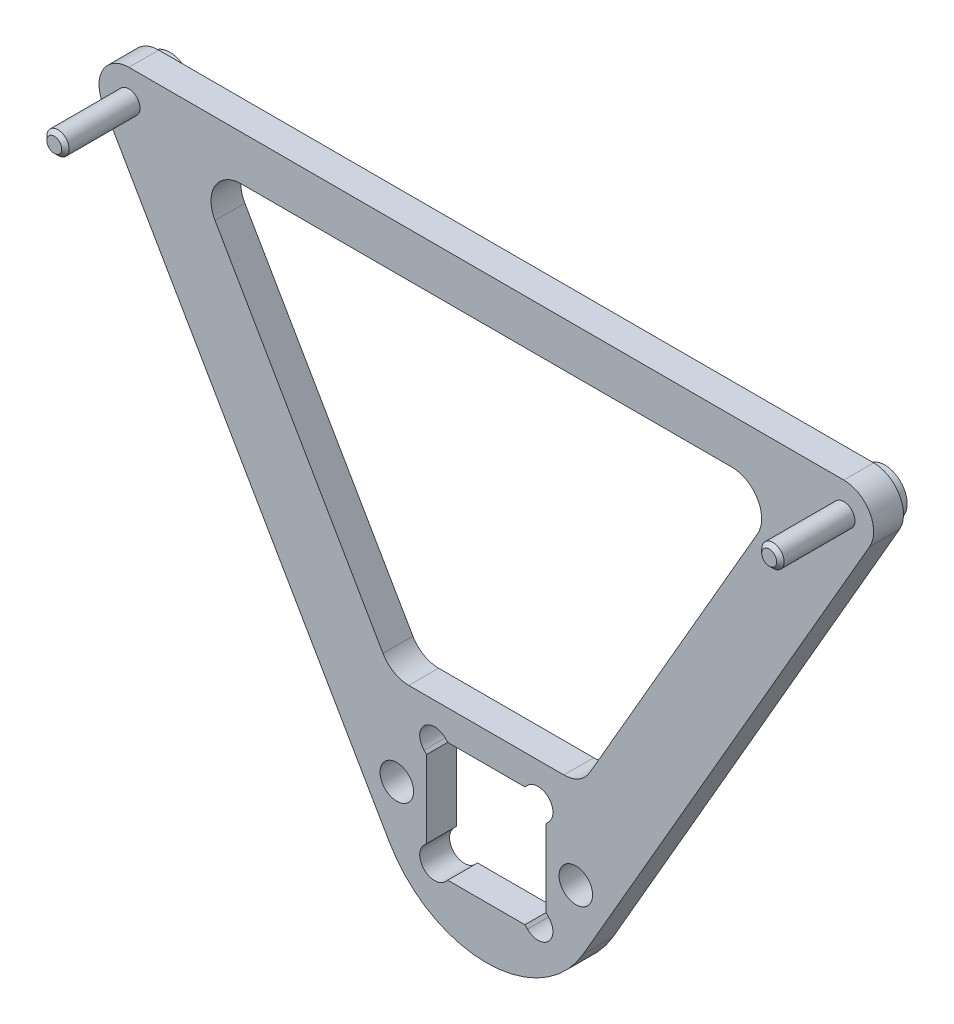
SolidWorks part; units mm, degrees
ref_plane "Plan de face" through (0, 0, 0) normal (0, 0, 1) x (1, 0, 0)
ref_plane "Plan de dessus" through (0, 0, 0) normal (0, 1, 0) x (1, 0, 0)
ref_plane "Plan de droite" through (0, 0, 0) normal (1, 0, 0) x (0, 0, -1)
sketch "Esquisse1" plane through (0, 0, 0) normal (0, 0, 1) x (1, 0, 0)
  line L0 (8.9257, 7.0549) -> (10.6336, 5.347) construction
  line L1 (-5.1716, 8) -> (5.1716, 8)
  line L2 (-8, 5.1716) -> (-8, -5.1716)
  line L3 (-5.1716, -8) -> (5.1716, -8)
  line L4 (8, 5.1716) -> (8, -5.1716)
  line L5 (7.9903, 7.9903) -> (6.9296, 6.9296) construction
  line L6 (8.3439, 5.5154) -> (3.5743, 10.285) construction
  line L7 (5.5154, 8.3439) -> (5.1716, 8)
  line L8 (8.3439, 5.5154) -> (8, 5.1716)
  line L9 (8.3439, -5.5154) -> (8, -5.1716)
  line L10 (5.5154, -8.3439) -> (5.1716, -8)
  line L11 (7.9903, -7.9903) -> (6.9296, -6.9296) construction
  line L12 (-5.5154, -8.3439) -> (-5.1716, -8)
  line L13 (-8.3439, -5.5154) -> (-8, -5.1716)
  line L14 (-7.9903, -7.9903) -> (-6.9296, -6.9296) construction
  line L15 (-8.3439, 5.5154) -> (-8, 5.1716)
  line L16 (-5.5154, 8.3439) -> (-5.1716, 8)
  line L17 (-7.9903, 7.9903) -> (-6.9296, 6.9296) construction
  line L18 (0, 40.1579) -> (0, -28.9881) construction
  line L19 (12.9904, -7.5) -> (51.3842, 59)
  line L20 (-12.9904, -7.5) -> (-51.3842, 59)
  line L21 (-47.9201, 65) -> (47.9201, 65)
  line L22 (-13.8564, 14) -> (-36.3731, 53)
  line L23 (10.3923, 12) -> (-10.3923, 12)
  line L24 (12.9904, -7.5) -> (54.8483, 65) construction
  line L25 (13.8564, 14) -> (36.3731, 53)
  line L26 (-4.3301, -2.5) -> (-37.5278, 55) construction
  line L27 (4.3301, -2.5) -> (37.5278, 55) construction
  line L28 (-32.909, 59) -> (32.909, 59)
  line L29 (-54.8483, 65) -> (54.8483, 65) construction
  line L30 (-37.5278, 55) -> (37.5278, 55) construction
  line L31 (-12.9904, -7.5) -> (-54.8483, 65) construction
  arc A0 (8.3439, 5.5154) -> (5.5154, 8.3439) centre (6.9296, 6.9296) ccw
  arc A1 (5.5154, -8.3439) -> (8.3439, -5.5154) centre (6.9296, -6.9296) ccw
  arc A2 (-8.3439, -5.5154) -> (-5.5154, -8.3439) centre (-6.9296, -6.9296) ccw
  arc A3 (-5.5154, 8.3439) -> (-8.3439, 5.5154) centre (-6.9296, 6.9296) ccw
  arc A4 (51.3842, 59) -> (47.9201, 65) centre (47.9201, 61) ccw
  arc A5 (-12.9904, -7.5) -> (12.9904, -7.5) centre (0, 0) ccw
  arc A6 (-51.3842, 59) -> (-47.9201, 65) centre (-47.9201, 61) cw
  arc A7 (-36.3731, 53) -> (-32.909, 59) centre (-32.909, 55) cw
  arc A8 (36.3731, 53) -> (32.909, 59) centre (32.909, 55) ccw
  arc A9 (13.8564, 14) -> (10.3923, 12) centre (10.3923, 16) cw
  arc A10 (-13.8564, 14) -> (-10.3923, 12) centre (-10.3923, 16) ccw
  circle A11 centre (-12, 0) radius 2.25
  circle A12 centre (12, 0) radius 2.25
  point P0 (-7.5417, 8.8)
  point P1 (8, -8)
  point P2 (-8, -8)
  point P4 (-15, 15)
  point P6 (15, 15)
  point P7 (15, -15)
  point P8 (-15, -15)
  point P10 (0, 0)
  dimension "D6" = 45
  dimension "D5" = 4
  dimension "D3" = 4
  dimension "D18" = 4.5
  dimension "D19" = 15
  dimension "D1" = 16
  dimension "D2" = 8
  dimension "D4" = 8
  dimension "D7" = 9.8
  dimension "D9" = 30
  dimension "D10" = 30
  dimension "D11" = 65
  dimension "D13" = 6
  dimension "D14" = 10
  dimension "D15" = 4
  dimension "D16" = 12
  dimension "D17" = 12
  dimension "D12" = 10
  dimension "D8" = 4
extrude "Boss.-Extru.1" add sketch "Esquisse1" along normal mid plane 4
sketch "Esquisse2" plane through (0, 0, 2) normal (0, 0, 1) x (1, 0, 0)
  circle A0 centre (-47.9201, 61) radius 1.5
  circle A1 centre (47.9201, 61) radius 1.5
  dimension "D1" = 3
extrude "Boss.-Extru.2" add sketch "Esquisse2" along normal blind 10
sketch "Esquisse3" plane through (0, 0, -2) normal (0, 0, -1) x (-1, 0, 0)
  circle A0 centre (-47.9201, 61) radius 3
  circle A1 centre (47.9201, 61) radius 3
  dimension "D1" = 6
extrude "Boss.-Extru.3" add sketch "Esquisse3" along normal blind 1.5
chamfer "Chanfrein1" distance 0.5 angle 45 2 edges at (49.4201, 61, 12) (-46.4201, 61, 12)
